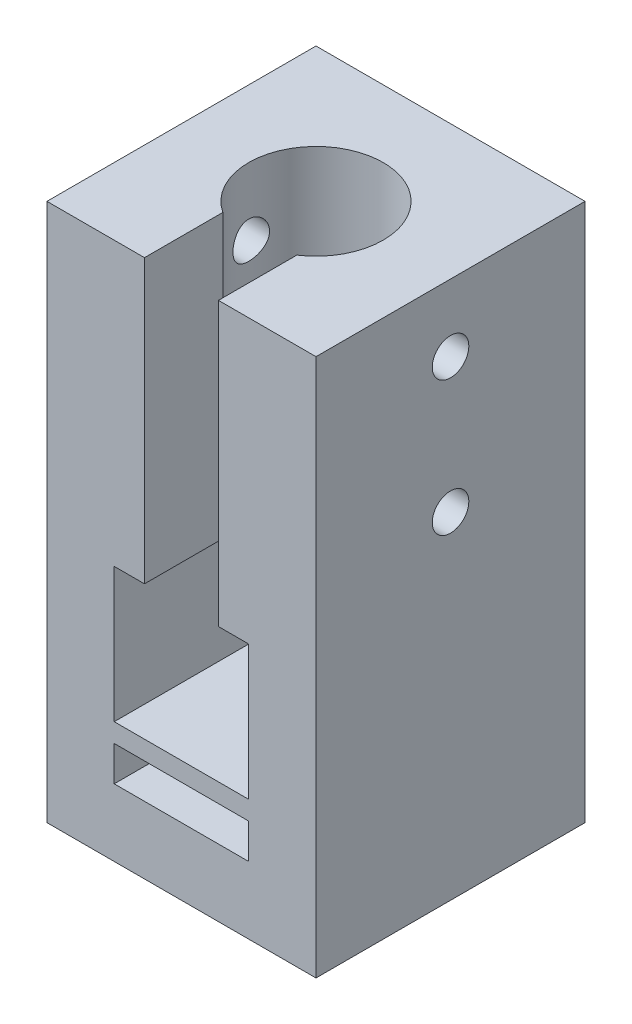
SolidWorks part; units mm, degrees
ref_plane "Front Plane" through (0, 0, 0) normal (0, 0, 1) x (1, 0, 0)
ref_plane "Top Plane" through (0, 0, 0) normal (0, 1, 0) x (1, 0, 0)
ref_plane "Right Plane" through (0, 0, 0) normal (1, 0, 0) x (0, 0, -1)
sketch "Sketch1" plane through (0, 0, 0) normal (0, 1, 0) x (1, 0, 0)
  line L1 (-37.6174, -1.9291) -> (-12.2174, -1.9291)
  line L2 (-37.6174, -1.9291) -> (-37.6174, 23.4709)
  line L3 (-37.6174, 23.4709) -> (-12.2174, 23.4709)
  line L4 (-12.2174, -1.9291) -> (-12.2174, 23.4709)
extrude "Boss-Extrude1" add sketch "Sketch1" along normal blind 50.8
sketch "Sketch2" plane through (0, 50.8, 0) normal (0, 1, 0) x (1, 0, 0)
  line L0 (-37.6174, 23.4709) -> (-37.6174, -1.9291) construction
  line L1 (-12.2174, 23.4709) -> (-37.6174, 23.4709) construction
  circle A0 centre (-24.9174, 10.7709) radius 6.35
  dimension "D1" = 12.7
  dimension "D2" = 12.7
extrude "Cut-Extrude1" cut sketch "Sketch2" against normal blind 25.4
sketch "Sketch3" plane through (0, 25.4, 0) normal (0, 1, 0) x (1, 0, 0)
  line L0 (-12.2174, 23.4709) -> (-37.6174, 23.4709) construction
  line L1 (-37.6174, 23.4709) -> (-37.6174, -1.9291) construction
  circle A0 centre (-24.9174, 10.7709) radius 3.81
  dimension "D1" = 12.7
  dimension "D2" = 12.7
extrude "Cut-Extrude3" cut sketch "Sketch3" against normal blind 19.05
sketch "Sketch4" plane through (0, 50.8, 0) normal (0, 1, 0) x (1, 0, 0)
  line L0 (-37.6174, -1.9291) -> (-12.2174, -1.9291) construction
  line L1 (-28.4099, -1.9291) -> (-21.4249, -1.9291)
  line L2 (-28.4099, -1.9291) -> (-28.4099, 10.7709)
  line L3 (-28.4099, 10.7709) -> (-21.4249, 10.7709)
  line L4 (-21.4249, -1.9291) -> (-21.4249, 10.7709)
  line L5 (-12.2174, -1.9291) -> (-12.2174, 23.4709) construction
  line L6 (-37.6174, 23.4709) -> (-37.6174, -1.9291) construction
  dimension "D1" = 9.2075
  dimension "D2" = 9.2075
extrude "Cut-Extrude4" cut sketch "Sketch4" against normal blind 38.1
sketch "Sketch5" plane through (0, 0, 1.9291) normal (0, 0, 1) x (1, 0, 0)
  line L0 (-12.2174, 50.8) -> (-12.2174, 0) construction
  line L1 (-31.2674, 24.13) -> (-18.5674, 24.13)
  line L2 (-31.2674, 24.13) -> (-31.2674, 11.43)
  line L3 (-31.2674, 11.43) -> (-18.5674, 11.43)
  line L4 (-18.5674, 24.13) -> (-18.5674, 11.43)
  line L5 (-37.6174, 0) -> (-12.2174, 0) construction
  dimension "D1" = 12.7
  dimension "D2" = 12.7
  dimension "D3" = 6.35
  dimension "D4" = 11.43
extrude "Cut-Extrude5" cut sketch "Sketch5" against normal through all
sketch "Sketch7" plane through (0, 50.8, 0) normal (0, 1, 0) x (1, 0, 0)
  line L0 (-12.2174, 23.4709) -> (-37.6174, 23.4709) construction
  line L1 (-37.6174, 23.4709) -> (-37.6174, -1.9291) construction
  circle A0 centre (-24.9174, 10.7709) radius 12.7
  dimension "D1" = 12.7
  dimension "D3" = 25.4
  dimension "D2" = 12.7
sketch "Sketch8" plane through (0, 0, 1.9291) normal (0, 0, 1) x (1, 0, 0)
  line L0 (-37.6174, 50.8) -> (-37.6174, 0) construction
  line L1 (-31.2674, 9.652) -> (-18.5674, 9.652)
  line L2 (-31.2674, 9.652) -> (-31.2674, 6.35)
  line L3 (-31.2674, 6.35) -> (-18.5674, 6.35)
  line L4 (-18.5674, 9.652) -> (-18.5674, 6.35)
  line L5 (-37.6174, 0) -> (-12.2174, 0) construction
  dimension "D1" = 12.7
  dimension "D2" = 3.302
  dimension "D3" = 6.35
  dimension "D4" = 6.35
extrude "Cut-Extrude7" cut sketch "Sketch8" against normal blind 12.7
hole_wizard "#8-32 Tapped Hole1" positions "Sketch9" profile "Sketch10" tap size "#8-32" standard "ANSI Inch"
sketch "Sketch9" plane through (-12.2174, 0, 0) normal (1, 0, 0) x (0, 0, -1)
  line L0 (23.4709, 50.8) -> (-1.9291, 50.8) construction
  line L1 (23.4709, 50.8) -> (23.4709, 0) construction
  point P0 (10.7709, 44.45)
  point P2 (10.7709, 31.75)
  dimension "D1" = 6.35
  dimension "D2" = 12.7
  dimension "D3" = 12.7
  dimension "D4" = 12.7
sketch "Sketch10" plane through (-12.2174, 44.45, -10.7709) normal (0, 1, 0) x (0, 0, -1)
  line L0 (0, 0) -> (0, 6.35)
  line L1 (0, 6.35) -> (1.7272, 6.35)
  line L2 (1.7272, 6.35) -> (1.7272, 0)
  line L5 (1.7272, 0) -> (0, 0)
  line L11 (0, -6.35) -> (0, 107.95) construction
  dimension "Thru Tap Drill Dia." = 3.4544
  dimension "Thru Tap Drill Depth" = 6.35
hole_wizard "#8-32 Tapped Hole2" positions "Sketch11" profile "Sketch12" tap size "#8-32" standard "ANSI Inch"
sketch "Sketch11" plane through (-37.6174, 0, 0) normal (-1, 0, 0) x (0, 0, 1)
  line L0 (1.9291, 50.8) -> (-23.4709, 50.8) construction
  line L1 (-23.4709, 50.8) -> (-23.4709, 0) construction
  point P0 (-10.7709, 44.45)
  point P2 (-10.7709, 31.75)
  dimension "D1" = 6.35
  dimension "D2" = 12.7
  dimension "D3" = 12.7
  dimension "D4" = 12.7
sketch "Sketch12" plane through (-37.6174, 44.45, -10.7709) normal (0, 1, 0) x (0, 0, 1)
  line L0 (0, 0) -> (0, 6.35)
  line L1 (0, 6.35) -> (1.7272, 6.35)
  line L2 (1.7272, 6.35) -> (1.7272, 0)
  line L5 (1.7272, 0) -> (0, 0)
  line L11 (0, -6.35) -> (0, 107.95) construction
  dimension "Thru Tap Drill Dia." = 3.4544
  dimension "Thru Tap Drill Depth" = 6.35
